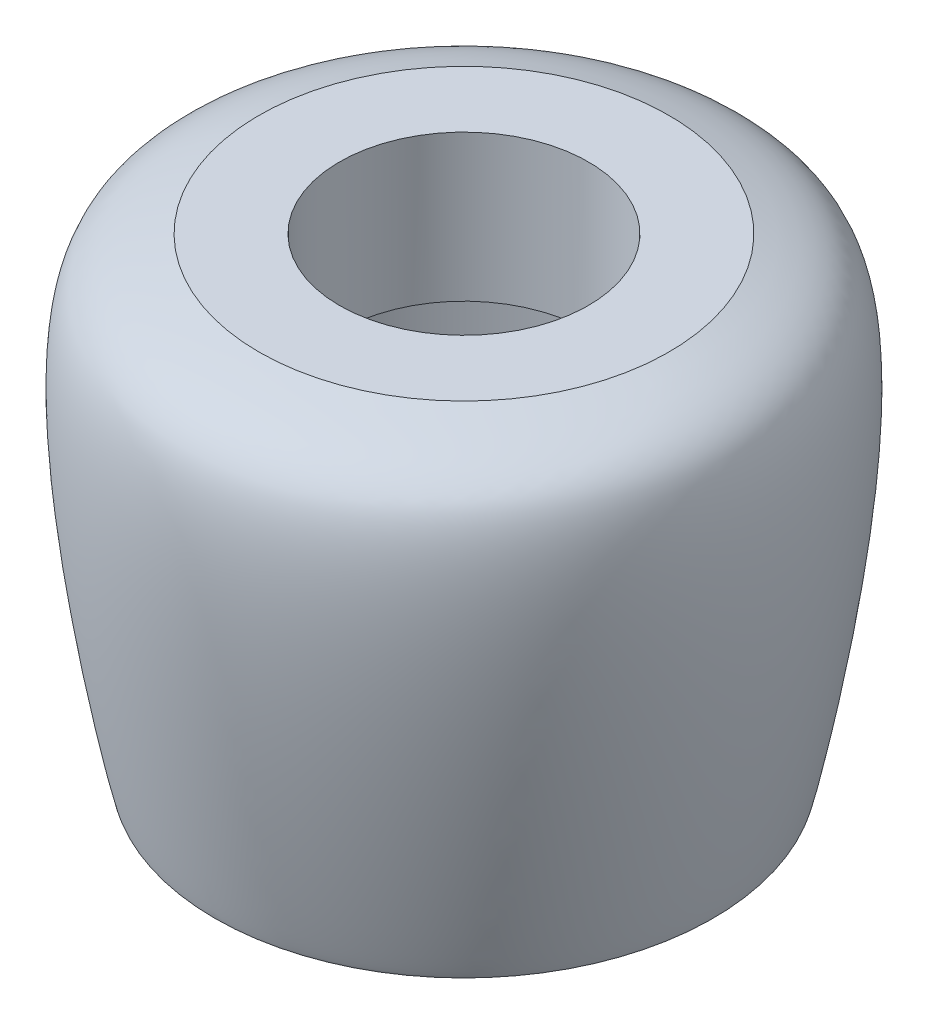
SolidWorks part; units mm, degrees
ref_plane "Plan de face" through (0, 0, 0) normal (0, 0, 1) x (1, 0, 0)
ref_plane "Plan de dessus" through (0, 0, 0) normal (0, 1, 0) x (1, 0, 0)
ref_plane "Plan de droite" through (0, 0, 0) normal (1, 0, 0) x (0, 0, -1)
sketch "Esquisse1" plane through (0, 0, 0) normal (0, 0, 1) x (1, 0, 0)
  line L0 (0, 84.3449) -> (0, -75.9968) construction
  line L1 (0, -3.7143) -> (7, -3.7143)
  line L2 (8.5, -19.7143) -> (0, -19.7143)
  line L3 (0, -3.7143) -> (0, -19.7143)
  spline S0 degree 3 poles (7, -3.7143) (8.0071, -4.0182) (9.0141, -4.322) (11.2158, -7.4255) (8.6783, -19.2333) (8.5, -19.7143) knots 0 0 0 0 0.220684 0.220684 1 1 1 1
  dimension "D4" = 16
  dimension "D1" = 8.5
  dimension "D2" = 7
  dimension "D3" = 9.5
revolve "Révolution1" add sketch "Esquisse1" angle 360 about L0
sketch "Esquisse2" plane through (0, -19.7143, 0) normal (0, -1, 0) x (1, 0, 0)
  circle A0 centre (0, 0) radius 8.421
  dimension "D1" = 16.8421
extrude "Enlèv. mat.-Extru.1" cut sketch "Esquisse2" against normal blind 11
sketch "Esquisse3" plane through (0, -3.7143, 0) normal (0, 1, 0) x (1, 0, 0)
  circle A0 centre (0, 0) radius 4.25
  dimension "D1" = 8.5
extrude "Enlèv. mat.-Extru.2" cut sketch "Esquisse3" against normal blind 11
